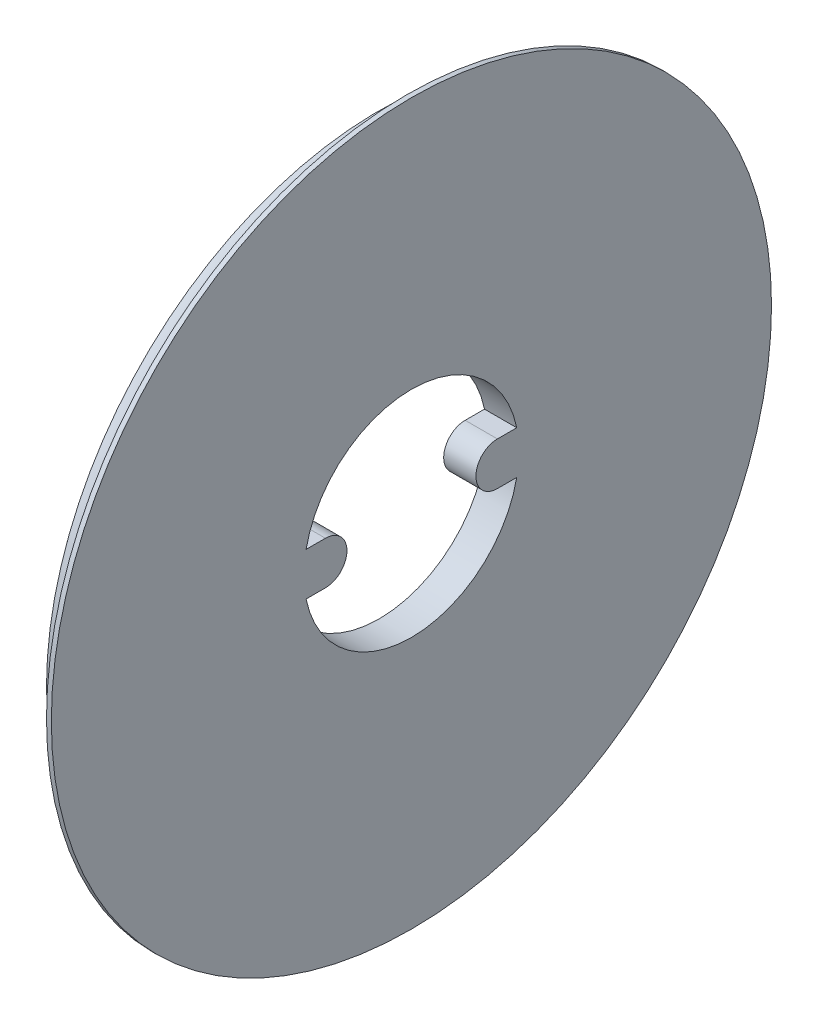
SolidWorks part; units mm, degrees
ref_plane "Plane1" through (0, 0, 0) normal (0, 0, 1) x (1, 0, 0)
ref_plane "Plane2" through (0, 0, 0) normal (0, 1, 0) x (1, 0, 0)
ref_plane "Plane3" through (0, 0, 0) normal (1, 0, 0) x (0, 0, -1)
sketch "Esquisse3" plane through (0, 0, 0) normal (0, 0, 1) x (1, 0, 0)
  line L0 (0, -12.3895) -> (0, 140.6228) construction
  line L1 (-19.0782, 0) -> (165.3613, 0) construction
  line L2 (6, 91.9241) -> (6, -6.8806) construction
  line L3 (-7.6644, 61.9) -> (65.197, 61.9) construction
  line L4 (-7.6644, 67) -> (93.8579, 67) construction
  line L5 (-7.6644, 80) -> (107.7261, 80) construction
  line L7 (12, -12.3895) -> (12, 140.6228) construction
  line L8 (-7.6644, 72.1) -> (65.197, 72.1) construction
  line L9 (6, 61.9) -> (6, 0)
  line L12 (-2.5, 99.8222) -> (-2.5, 77.136) construction
  line L19 (11.1, 67) -> (12, 67)
  line L20 (12, 67) -> (12, 0)
  line L21 (12, 0) -> (6, 0)
  circle A0 centre (6, 67) radius 5 construction
  arc A1 (6, 61.9) -> (11.1, 67) centre (6, 67) ccw
  dimension "D7" = 5.1
  dimension "D4" = 67
  dimension "D2" = 80
  dimension "D5" = 12
  dimension "D6" = 5.1
  dimension "D11" = 2.5
revolve "Révolution1" add sketch "Esquisse3" angle 360 about L1
sketch "Esquisse5" plane through (6, 0, 0) normal (-1, 0, 0) x (0, 0, 1)
  line L0 (0, -35.731) -> (0, 32.7316) construction
  line L1 (-23.0499, 0) -> (37.1846, 0) construction
  line L2 (-12, 6.3315) -> (-12, -1.869) construction
  line L3 (-16, 6.3315) -> (-16, -1.869) construction
  line L4 (-25.5061, 4) -> (-7.3619, 4) construction
  line L5 (-25.5061, -4) -> (-7.3619, -4) construction
  line L6 (-19.5959, 4) -> (-16, 4)
  line L7 (-19.5959, -4) -> (-16, -4)
  line L8 (19.5959, -4) -> (16, -4)
  line L9 (19.5959, 4) -> (16, 4)
  arc A1 (-19.5959, -4) -> (19.5959, -4) centre (0, 0) ccw
  arc A8 (-16, -4) -> (-16, 4) centre (-16, 0) ccw
  arc A9 (16, -4) -> (16, 4) centre (16, 0) cw
  arc A10 (19.5959, 4) -> (-19.5959, 4) centre (0, 0) ccw
  dimension "D2" = 4
  dimension "D3" = 8
  dimension "D4" = 4
  dimension "D5" = 12
extrude "Enlèv. mat.-Extru.1" cut sketch "Esquisse5" against normal blind 6
sketch "Esquisse6" plane through (6, 0, 0) normal (-1, 0, 0) x (0, 0, 1)
  line L0 (0, -40.6313) -> (0, 37.817) construction
  circle A0 centre (0, 0) radius 30 construction
  circle A1 centre (0, 30) radius 1.1
  circle A2 centre (25.9808, 15) radius 1.1
  circle A3 centre (25.9808, -15) radius 1.1
  circle A4 centre (0, -30) radius 1.1
  circle A5 centre (-25.9808, -15) radius 1.1
  circle A6 centre (-25.9808, 15) radius 1.1
  dimension "D1" = 6
extrude "Enlèv. mat.-Extru.2" cut sketch "Esquisse6" against normal blind 4
